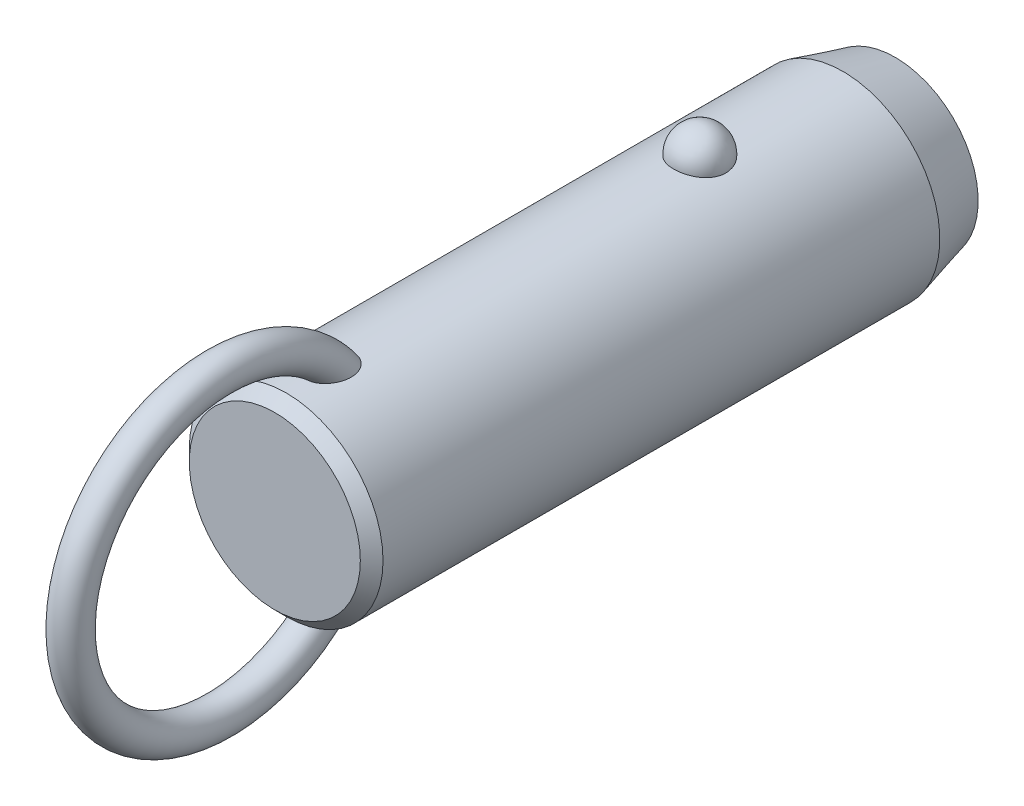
SolidWorks part; units mm, degrees
ref_plane "Front Plane" through (0, 0, 0) normal (0, 0, 1) x (1, 0, 0)
ref_plane "Top Plane" through (0, 0, 0) normal (0, 1, 0) x (1, 0, 0)
ref_plane "Right Plane" through (0, 0, 0) normal (1, 0, 0) x (0, 0, -1)
sketch "Sketch2" plane through (0, 0, 0) normal (0, 0, 1) x (1, 0, 0)
  circle A0 centre (0, 0) radius 11.1
  point P3 (0, 11.1)
  dimension "D1" = 22.2
extrude "Boss-Extrude1" add sketch "Sketch2" along normal blind 33
sketch "Sketch3" plane through (0, 0, 0) normal (0, 0, -1) x (-1, 0, 0)
  circle A0 centre (0, 0) radius 11.1
  dimension "D1" = 22.2
extrude "Boss-Extrude2" add sketch "Sketch3" along normal blind 25.4
chamfer "Chamfer1" distance 6 angle 15 1 edges at (-11.1, 0, -25.4)
sketch "Sketch12" plane through (0, 0, 0) normal (1, 0, 0) x (0, 0, -1)
  line L0 (-33, 11.1) -> (-33, -11.1) construction
  point P0 (-33, 0)
sketch "Sketch13" plane through (0, 0, 0) normal (1, 0, 0) x (0, 0, -1)
  circle A0 centre (-52.05, 0) radius 19.05
  point P2 (-33, 0)
  dimension "D1" = 38.1
sketch "Sketch14" plane through (0, 0, 0) normal (0, 1, 0) x (1, 0, 0)
  circle A0 centre (0, -35) radius 2
  point P2 (0, -33)
  dimension "D1" = 4
sweep "Sweep1" add profiles "Sketch14" path "Sketch13"
sketch "Sketch15" plane through (0, 0, 33) normal (0, 0, 1) x (1, 0, 0)
  circle A0 centre (0, 0) radius 11.1
  dimension "D1" = 22.2
extrude "Boss-Extrude3" add sketch "Sketch15" along normal blind 12.7
chamfer "Chamfer2" distance 1.3 angle 45 1 edges at (11.1, 0, 45.7)
sketch "Sketch18" plane through (0, 0, 0) normal (1, 0, 0) x (0, 0, -1)
  line L0 (19.4, 11.1) -> (-36.568, 11.1) construction
  line L1 (3, 14.1) -> (3, 8.1)
  line L2 (-36.568, -11.1) -> (19.4, -11.1) construction
  arc A0 (3, 14.1) -> (3, 8.1) centre (3, 11.1) ccw
  point P4 (0, 11.1)
  dimension "D1" = 25.2
revolve "Revolve1" add sketch "Sketch18" angle 360 about L1
